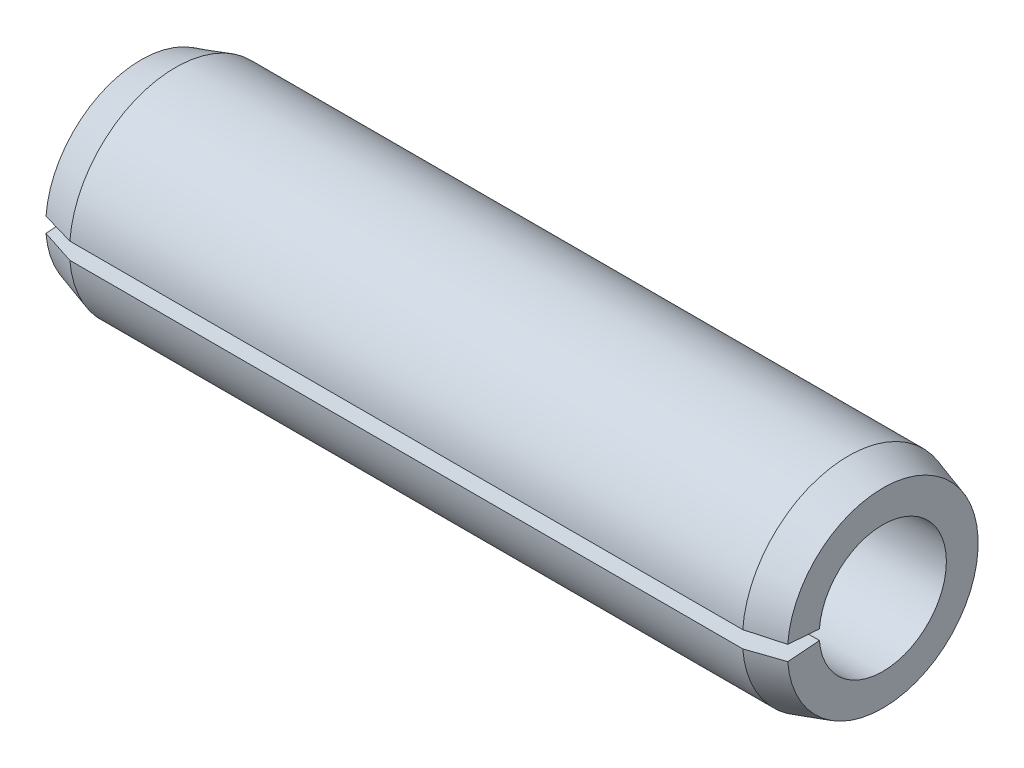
SolidWorks part; units mm, degrees
ref_plane "Plane1" through (0, 0, 0) normal (0, 0, 1) x (1, 0, 0)
ref_plane "Plane2" through (0, 0, 0) normal (0, 1, 0) x (1, 0, 0)
ref_plane "Plane3" through (0, 0, 0) normal (1, 0, 0) x (0, 0, -1)
sketch "Sketch1" plane through (0, 0, 0) normal (0, 0, 1) x (1, 0, 0)
  line L0 (-9.525, 0) -> (111.125, 0) construction
  line L1 (0, 1.2) -> (14, 1.2)
  line L2 (14, 1.2) -> (14, 1.8)
  line L3 (14, 1.8) -> (13.35, 2)
  line L4 (13.35, 2) -> (0.65, 2)
  line L5 (0.65, 2) -> (0, 1.8)
  line L7 (0, 1.8) -> (0, 1.2)
revolve "Base-Revolve" add sketch "Sketch1" angle 360 about L0
sketch "Sketch2" plane through (0, 0, 0) normal (-1, 0, 0) x (0, -1, 0)
  line L0 (0, 0) -> (0.1601, 2.0337)
  line L1 (0, -3.175) -> (0, 12.7) construction
  line L2 (0, 0) -> (-0.1601, 2.0337)
  arc A0 (0.1601, 2.0337) -> (-0.1601, 2.0337) centre (0, 0) ccw
extrude "Gap" cut sketch "Sketch2" against normal through all
equation "\"D1@Sketch2\" = \"Diameter@Sketch1\" * 0.51"
equation "\"D1@Sketch1\" = \"Diameter@Sketch1\" -  ( \"Thickness@Sketch1\" / 2 ) "
equation "\"D2@Sketch1\" = \"D1@Sketch1\""
equation "\"D3@Sketch1\" = \"Chamfer_len@Sketch1\""
